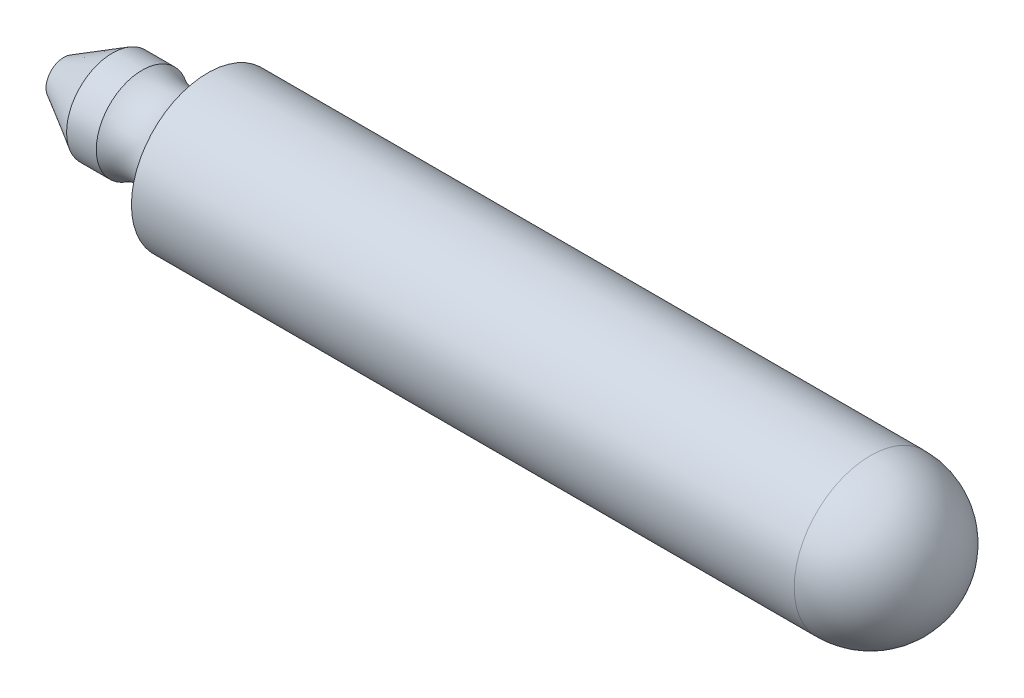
SolidWorks part; units mm, degrees
ref_plane "Front Plane" through (0, 0, 0) normal (0, 0, 1) x (1, 0, 0)
ref_plane "Top Plane" through (0, 0, 0) normal (0, 1, 0) x (1, 0, 0)
ref_plane "Right Plane" through (0, 0, 0) normal (1, 0, 0) x (0, 0, -1)
sketch "Sketch1" plane through (0, 0, 0) normal (0, 0, 1) x (1, 0, 0)
  line L0 (0, 0) -> (4354.9653, 0) construction
  line L1 (0, 0) -> (0, 0.3175)
  line L2 (0, 0.3175) -> (0.8689, 0.8192)
  line L3 (0.8689, 0.8192) -> (1.3987, 0.8192)
  line L4 (2.5654, 1.3589) -> (14.3891, 1.3589)
  line L5 (0, 0) -> (15.748, 0)
  arc A0 (1.3987, 0.8192) -> (2.5654, 1.3589) centre (1.8102, 1.4605) ccw
  arc A1 (14.3891, 1.3589) -> (15.748, 0) centre (14.3891, 0) cw
  dimension "D1" = 0.762
  dimension "D2" = 30
  dimension "D3" = 0.3175
  dimension "D4" = 1.3589
  dimension "D5" = 15.748
  dimension "D6" = 13.1826
  dimension "D7" = 0.8192
  dimension "D8" = 1.4605
revolve "Revolve1" add sketch "Sketch1" angle 360 about L0
